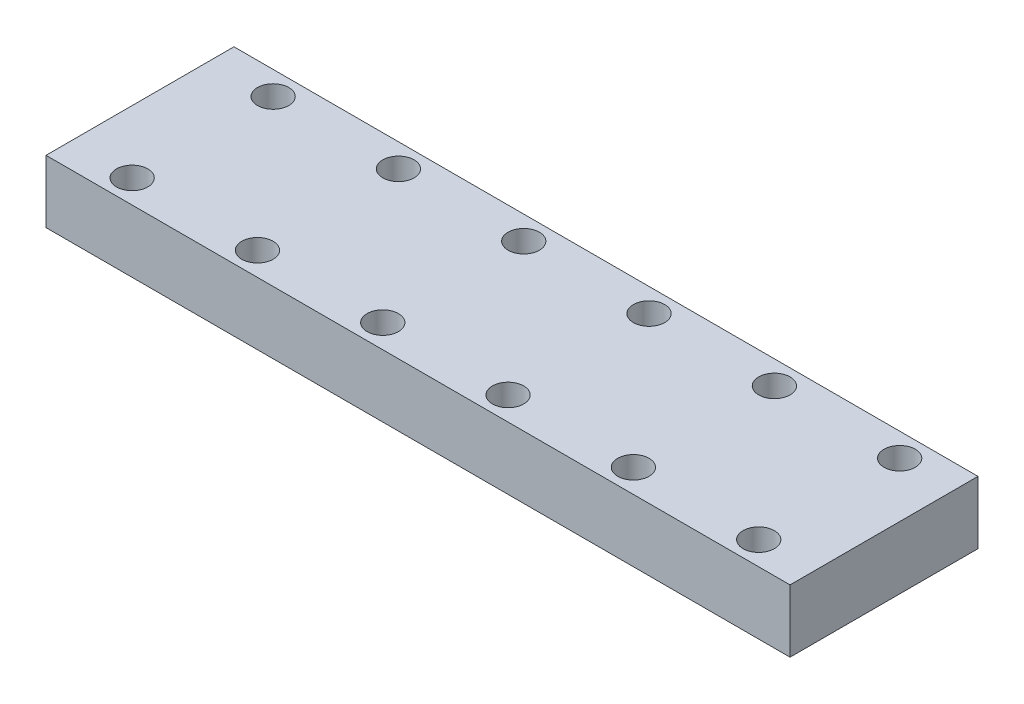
SolidWorks part; units mm, degrees
ref_plane "前视基准面" through (0, 0, 0) normal (0, 0, 1) x (1, 0, 0)
ref_plane "上视基准面" through (0, 0, 0) normal (0, 1, 0) x (1, 0, 0)
ref_plane "右视基准面" through (0, 0, 0) normal (1, 0, 0) x (0, 0, -1)
sketch "草图1" plane through (0, 0, 0) normal (0, 1, 0) x (1, 0, 0)
  line L1 (-18.2907, 13.163) -> (76.7093, 13.163)
  line L2 (-18.2907, 13.163) -> (-18.2907, -10.837)
  line L3 (-18.2907, -10.837) -> (76.7093, -10.837)
  line L4 (76.7093, 13.163) -> (76.7093, -10.837)
  circle A0 centre (-10.2907, 10.163) radius 2
  circle A1 centre (5.7093, 10.163) radius 2
  circle A2 centre (21.7093, 10.163) radius 2
  circle A3 centre (37.7093, 10.163) radius 2
  circle A4 centre (53.7093, 10.163) radius 2
  circle A5 centre (69.7093, 10.163) radius 2
  circle A6 centre (-10.2907, -7.837) radius 2
  circle A7 centre (5.7093, -7.837) radius 2
  circle A8 centre (21.7093, -7.837) radius 2
  circle A9 centre (37.7093, -7.837) radius 2
  circle A10 centre (53.7093, -7.837) radius 2
  circle A11 centre (69.7093, -7.837) radius 2
  dimension "D3" = 8
  dimension "D1" = 24
  dimension "D2" = 95
  dimension "D4" = 3
  dimension "D5" = 2
  dimension "D6" = 2
  dimension "D7" = 2
  dimension "D8" = 2
extrude "凸台-拉伸1" add sketch "草图1" along normal blind 8
